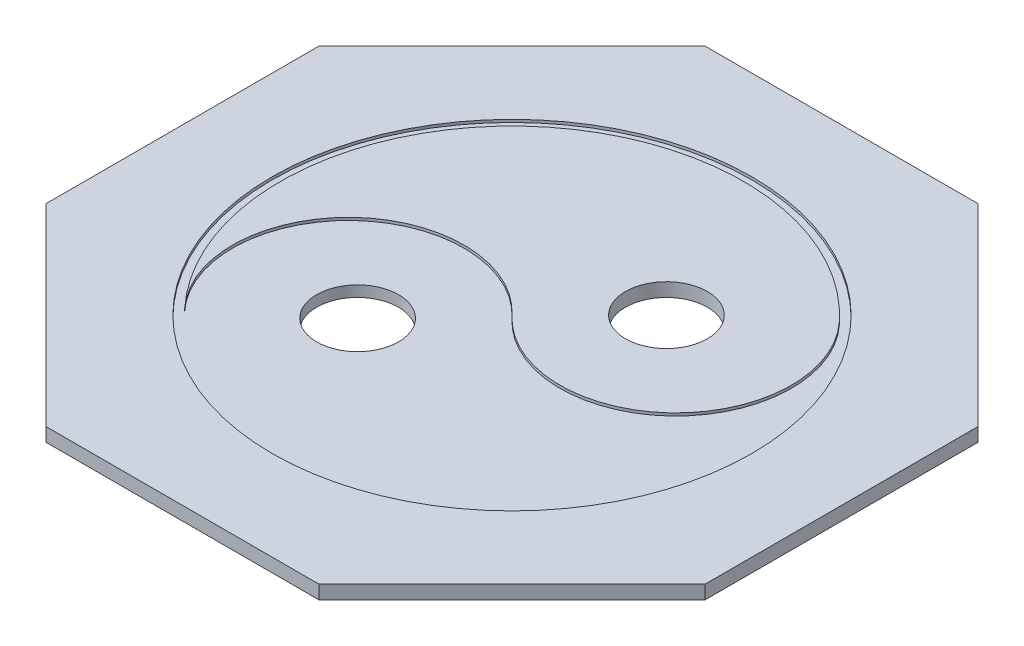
SolidWorks part; units mm, degrees
ref_plane "Alzado" through (0, 0, 0) normal (0, 0, 1) x (1, 0, 0)
ref_plane "Planta" through (0, 0, 0) normal (0, 1, 0) x (1, 0, 0)
ref_plane "Vista lateral" through (0, 0, 0) normal (1, 0, 0) x (0, 0, -1)
sketch "Croquis1" plane through (0, 0, 0) normal (0, 1, 0) x (1, 0, 0)
  line L0 (1.6051, -84.3795) -> (101.6051, -84.3795)
  line L1 (101.6051, -84.3795) -> (172.3158, -13.6688)
  line L2 (172.3158, -13.6688) -> (172.3158, 86.3312)
  line L3 (172.3158, 86.3312) -> (101.6051, 157.0418)
  line L4 (101.6051, 157.0418) -> (1.6051, 157.0418)
  line L5 (1.6051, 157.0418) -> (-69.1055, 86.3312)
  line L6 (-69.1055, 86.3312) -> (-69.1055, -13.6688)
  line L7 (-69.1055, -13.6688) -> (1.6051, -84.3795)
  circle A0 centre (23.3209, 8.0469) radius 15
  circle A1 centre (79.8894, 64.6154) radius 15
  dimension "D1" = 100
  dimension "D2" = 100
  dimension "D3" = 100
  dimension "D4" = 100
  dimension "D6" = 100
  dimension "D8" = 100
  dimension "D9" = 100
extrude "Saliente-Extruir1" add sketch "Croquis1" along normal blind 5
sketch "Croquis2" plane through (0, 5, 0) normal (0, 1, 0) x (1, 0, 0)
  arc A0 (113.6328, 94.2265) -> (-10.4225, -21.5642) centre (51.6051, 36.3312) ccw
  circle A1 centre (51.6051, 36.3312) radius 87.8487
  arc A2 (51.6051, 36.3312) -> (-10.4225, -21.5642) centre (20.5913, 7.3835) ccw
  arc A3 (51.6051, 36.3312) -> (113.6328, 94.2265) centre (82.619, 65.2788) ccw
extrude "Cortar-Extruir1" cut sketch "Croquis2" against normal blind 1 contours A1 A3 A2 A0 M1
